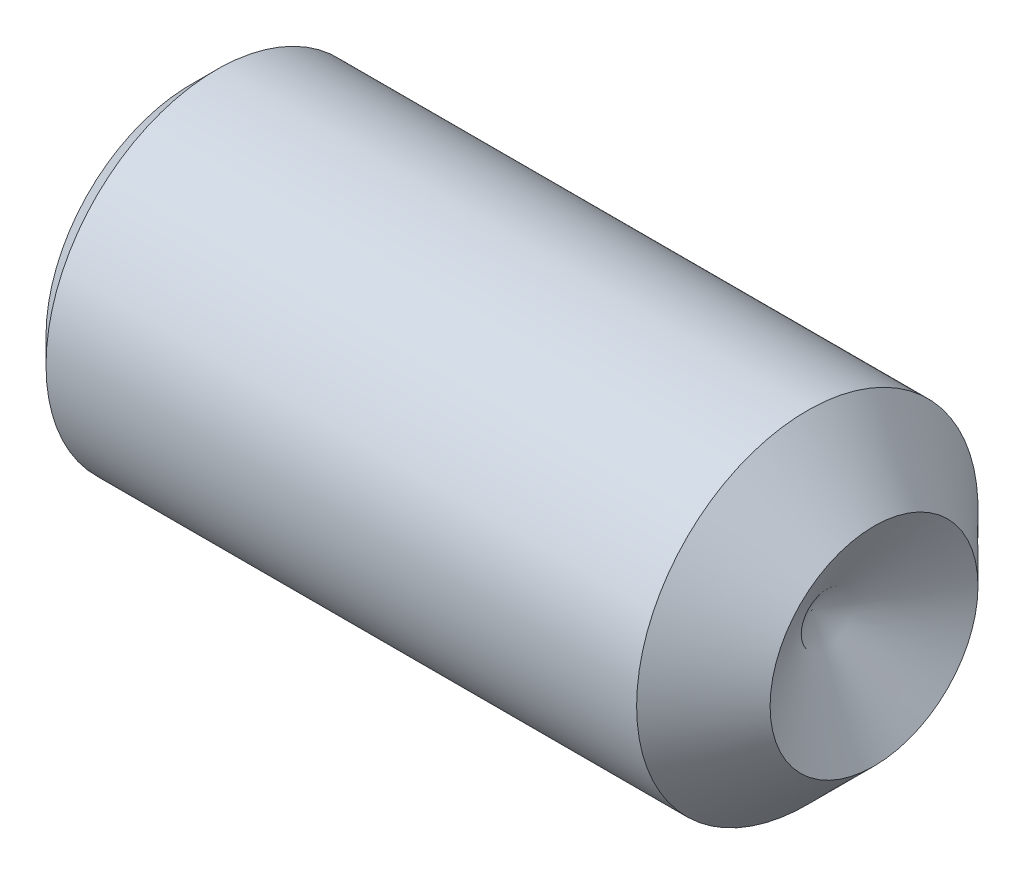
SolidWorks part; units mm, degrees
ref_plane "Plane1" through (0, 0, 0) normal (0, 0, 1) x (1, 0, 0)
ref_plane "Plane2" through (0, 0, 0) normal (0, 1, 0) x (1, 0, 0)
ref_plane "Plane3" through (0, 0, 0) normal (1, 0, 0) x (0, 0, -1)
sketch "BodySke" plane through (0, 0, 0) normal (0, 0, 1) x (1, 0, 0)
  line L0 (0, 0) -> (0, 10.8102)
  line L1 (0, 10.8102) -> (1.8898, 12.7)
  line L2 (1.8898, 12.7) -> (45.8343, 12.7)
  line L3 (45.8343, 12.7) -> (50.8, 7.7343)
  line L4 (46.1528, 0) -> (0, 0)
  line L5 (-12.7, 0) -> (88.9, 0) construction
  line L6 (46.1528, 0) -> (50.8, 7.7343)
  line L7 (50.8, 7.7343) -> (50.8, 17.2593) construction
  line L8 (0, -10.8102) -> (1.8898, -12.7) construction
  line L9 (46.1528, 0) -> (50.8, -7.7343) construction
  line L10 (45.8343, -12.7) -> (50.8, -7.7343) construction
  line L11 (2.1082, 15.875) -> (2.1082, -3.175) construction
  dimension "Length" = 50.8
  dimension "Diameter" = 25.4
  dimension "Drive_ch_ang" = 45
  dimension "Minor_dia" = 21.6205
  dimension "Cup_nose_ang" = 45
  dimension "Cup_ang" = 118
  dimension "Cup_dia" = 15.4686
  dimension "Advance" = 2.1082
revolve "BaseBody" add sketch "BodySke" angle 360 about L5
sketch "Sketch2" plane through (0, 0, 0) normal (-1, 0, 0) x (0, 0, 1)
  line L0 (4.1208, 7.1374) -> (-4.1208, 7.1374)
  line L1 (-4.1208, 7.1374) -> (-8.2416, 0)
  line L2 (4.1208, 7.1374) -> (8.2416, 0)
  line L3 (4.1208, -7.1374) -> (8.2416, 0)
  line L4 (4.1208, -7.1374) -> (-4.1208, -7.1374)
  line L5 (-4.1208, -7.1374) -> (-8.2416, 0)
  dimension "Hex_size" = 14.2748
  dimension "D2" = 7.1374
  dimension "D3" = 7.1374
extrude "Hex" cut sketch "Sketch2" against normal blind 14.2748
sketch "Sketch4" plane through (0, 4.7709, -0.5249) normal (-1, 0, 0) x (0, 0, 1)
  line L0 (0.5249, -4.7709) -> (10.6976, -4.7709)
  line L1 (0.5249, -4.7709) -> (6.6732, -1.2211) construction
  line L2 (0.5249, -4.7709) -> (5.6112, 4.0389)
  line L3 (8.9666, -2.6687) -> (10.2861, -1.9069)
  line L4 (6.5663, 1.4888) -> (7.8858, 2.2506)
  arc A0 (8.9666, -2.6687) -> (6.5663, 1.4888) centre (0.5249, -4.7709) ccw
  arc A1 (10.6976, -4.7709) -> (10.2861, -1.9069) centre (0.5249, -4.7709) ccw
  arc A2 (5.6112, 4.0389) -> (7.8858, 2.2506) centre (0.5249, -4.7709) cw
  circle A3 centre (0.5249, -4.7709) radius 8.6995 construction
  circle A4 centre (0.5249, -4.7709) radius 10.1727 construction
  dimension "D1" = 30
  dimension "Spline_n_dim" = 17.399
  dimension "Spline_m_dim" = 20.3454
  dimension "Spline_a_dim" = 60
  dimension "D3" = 2.4003
  dimension "Spline_p_dim" = 4.8006
extrude "Spline" [suppressed] cut sketch "Sketch4" against normal blind 12.7
pattern_circular "CirPattern1" [suppressed] count 6 every 60 about axis through (-12.7, 0, 0) along (1, 0, 0)
sketch "ThdSchSke" plane through (0, 0, 0) normal (0, 0, 1) x (1, 0, 0)
  line L0 (1.8898, -10.8102) -> (0.5665, -12.7)
  line L1 (1.8898, -10.8102) -> (3.213, -12.7)
  line L2 (3.213, -12.7) -> (3.213, -15.875)
  line L3 (-3.175, 0) -> (5.1513, 0) construction
  line L4 (1.8898, 12.7) -> (1.8898, -12.7) construction
  line L5 (3.213, -15.875) -> (0.5665, -15.875)
  line L6 (0.5665, -15.875) -> (0.5665, -12.7)
  dimension "Thread_minor" = 21.6205
  dimension "Diameter" = 25.4
  dimension "SideAngle" = 55
  dimension "VeeAngle" = 70
  dimension "Overcut" = 31.75
revolve "ThreadSchematic" [suppressed] cut sketch "ThdSchSke" angle 360 about L3
pattern_linear "ThdSchPat" [suppressed]
equation "\"D2@Sketch2\" = \"Hex_size@Sketch2\" / 2"
equation "\"D3@Sketch2\" = \"Hex_size@Sketch2\" / 2"
equation "\"Thread_minor@ThreadCosmetic\" = \"Minor_dia@BodySke\""
equation "\"D1@Sketch4\" = \"Spline_a_dim@Sketch4\" / 2"
equation "\"D3@Sketch4\" = \"Spline_p_dim@Sketch4\" / 2"
equation "\"D2@CirPattern1\" = \"Spline_a_dim@Sketch4\""
equation "\"Num_teeth@CirPattern1\" = 360 / \"D2@CirPattern1\""
equation "\"Thread_minor@ThdSchSke\" = \"Thread_minor@ThreadCosmetic\""
equation "\"Diameter@ThdSchSke\" = \"Diameter@BodySke\""
equation "\"Overcut@ThdSchSke\" = \"Diameter@BodySke\" * 1.25"
equation "\"Num_threads@ThdSchPat\" = int( (\"Length@BodySke\" - ( ( ( \"Diameter@BodySke\" - \"Minor_dia@BodySke\" ) * 0.5 ) / tan( \"Drive_ch_ang@BodySke\" * 0.017453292 ) ) - ( ( ( \"Diameter@BodySke\" - \"Cup_dia@BodySk"
equation "\"Advance@ThdSchPat\" = (\"Length@BodySke\" - ( ( ( \"Diameter@BodySke\" - \"Minor_dia@BodySke\" ) * 0.5 ) / tan( \"Drive_ch_ang@BodySke\" * 0.017453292 ) ) - ( ( ( \"Diameter@BodySke\" - \"Cup_dia@BodySke\" ) * 0."
equation "' \"Num_threads@ThdSchPat\" = \"Num_threads@ThdSchPat\" - sgn( \"Num_threads@ThdSchPat\" - 1) '---chamfered tips only---"
